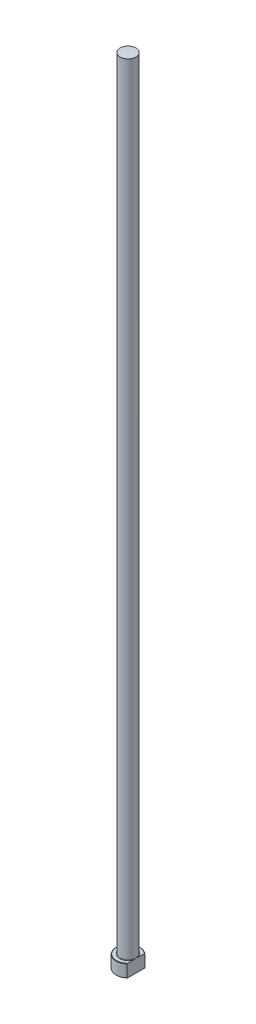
SolidWorks part; units mm, degrees
ref_plane "Front Plane" through (0, 0, 0) normal (0, 0, 1) x (1, 0, 0)
ref_plane "Top Plane" through (0, 0, 0) normal (0, 1, 0) x (1, 0, 0)
ref_plane "Right Plane" through (0, 0, 0) normal (1, 0, 0) x (0, 0, -1)
sketch "Sketch1" plane through (0, 0, 0) normal (0, 0, 1) x (1, 0, 0)
  line L0 (0, 259.9588) -> (0, -15.1925) construction
  line L1 (0, 0) -> (-7.5, 0)
  line L2 (-7.5, 0) -> (-7.5, 8)
  line L3 (-7.5, 8) -> (-5, 8)
  line L4 (-5, 8) -> (-5, 500)
  line L5 (-5, 500) -> (0, 500)
  line L6 (0, 500) -> (0, 0)
  dimension "L" = 500
  dimension "H" = 15
  dimension "T" = 8
  dimension "D" = 10
revolve "Revolve1" add sketch "Sketch1" angle 360 about L0
chamfer "Chamfer1" distance 0.2 angle 45 2 edges at (0, 8, 7.5) (0, 0, 7.5)
fillet "Fillet1" radius 0.3 1 edges at (0, 8, 5)
sketch "Sketch2" plane through (0, 0, 0) normal (0, 1, 0) x (1, 0, 0)
  line L0 (5, -5.5902) -> (5, 5.5902)
  circle A0 centre (0, 0) radius 7.5 construction
  arc A1 (5, -5.5902) -> (5, 5.5902) centre (0, 0) ccw
  circle A2 centre (0, 0) radius 5 construction
extrude "KEYED HEAD" cut sketch "Sketch2" along normal through all
